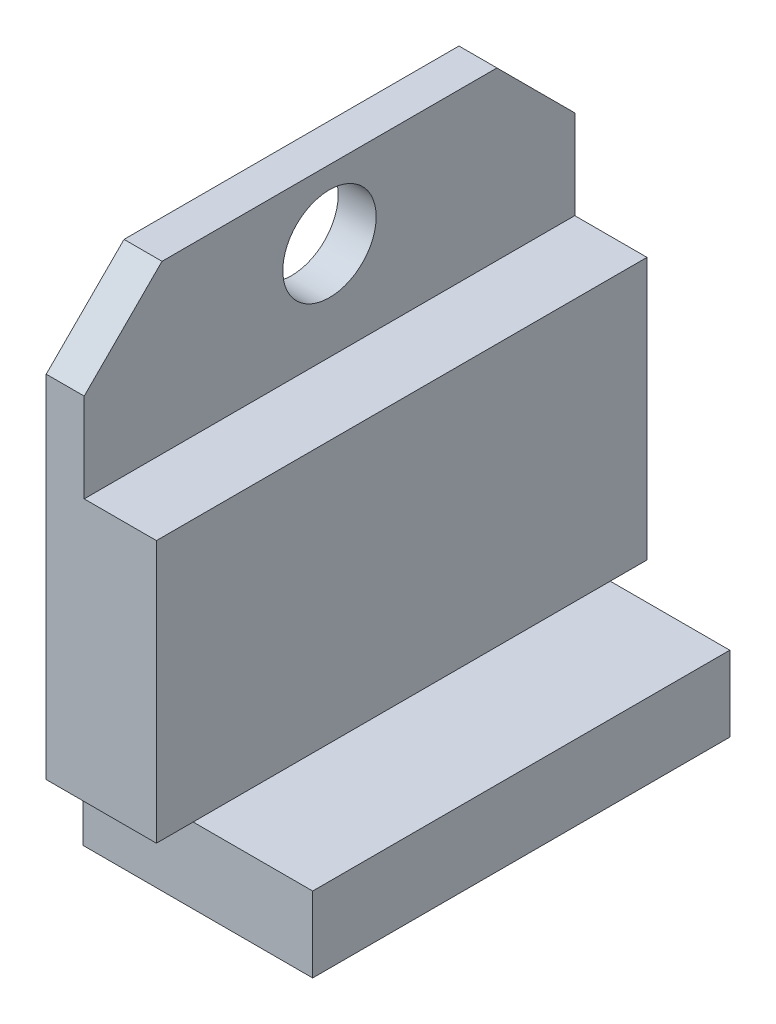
SolidWorks part; units mm, degrees
ref_plane "Front Plane" through (0, 0, 0) normal (0, 0, 1) x (1, 0, 0)
ref_plane "Top Plane" through (0, 0, 0) normal (0, 1, 0) x (1, 0, 0)
ref_plane "Right Plane" through (0, 0, 0) normal (1, 0, 0) x (0, 0, -1)
sketch "Sketch1" plane through (0, 0, 0) normal (1, 0, 0) x (0, 0, -1)
  line L0 (10.0076, 17.5006) -> (10.0076, 0) construction
  line L1 (0, 0) -> (20.0152, 0)
  line L2 (0, 0) -> (0, 17.5006)
  line L3 (0, 17.5006) -> (20.0152, 17.5006)
  line L4 (20.0152, 0) -> (20.0152, 17.5006)
  line L5 (0, 14.7066) -> (20.0152, 14.7066) construction
  circle A0 centre (10.0076, 14.7066) radius 1.905
  dimension "D4" = 3.81
  dimension "D1" = 20.0152
  dimension "D2" = 17.5006
  dimension "D3" = 2.794
extrude "Extrude1" add sketch "Sketch1" along normal blind 1.5494
chamfer "Chamfer1" distance 3.175 angle 45 2 edges at (0.7747, 17.5006, 0) (0.7747, 17.5006, -20.0152)
sketch "Sketch2" plane through (1.5494, 0, 0) normal (1, 0, 0) x (0, 0, -1)
  line L0 (20.0152, 0) -> (20.0152, 14.3256) construction
  line L1 (0, 0) -> (20.0152, 0)
  line L2 (0, 0) -> (0, 10.6934)
  line L3 (0, 10.6934) -> (20.0152, 10.6934)
  line L4 (20.0152, 0) -> (20.0152, 10.6934)
  dimension "D1" = 10.6934
extrude "Extrude2" add sketch "Sketch2" along normal blind 2.9464
sketch "Sketch3" plane through (0, 0, 0) normal (0, -1, 0) x (1, 0, 0)
  line L0 (0, 0) -> (0, -20.0152) construction
  line L1 (0, -1.4986) -> (9.3726, -1.4986)
  line L2 (0, -1.4986) -> (0, -18.5166)
  line L3 (0, -18.5166) -> (9.3726, -18.5166)
  line L4 (9.3726, -1.4986) -> (9.3726, -18.5166)
  line L5 (4.4958, -10.0076) -> (0, -10.0076) construction
  line L6 (4.4958, 0) -> (4.4958, -20.0152) construction
  dimension "D1" = 17.018
  dimension "D2" = 9.3726
  dimension "D3" = 8.509
extrude "Extrude3" add sketch "Sketch3" along normal blind 3.0734
